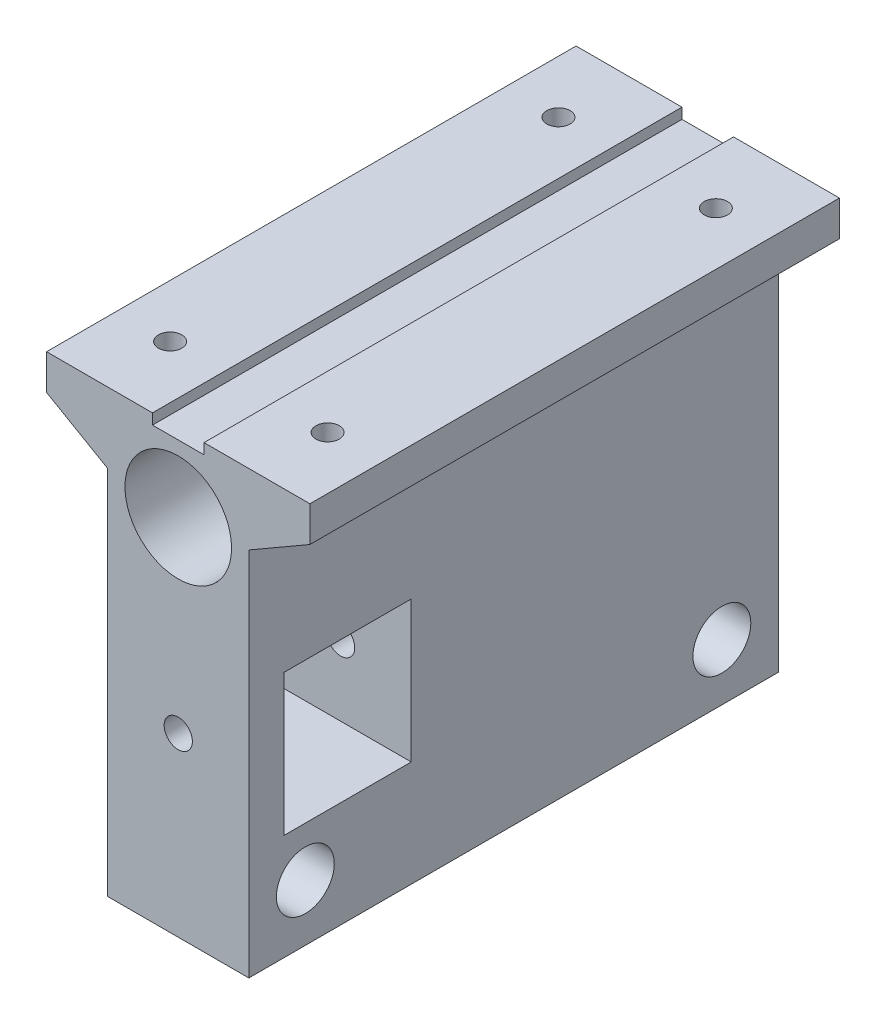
SolidWorks part; units mm, degrees
ref_plane "Alzado" through (0, 0, 0) normal (0, 0, 1) x (1, 0, 0)
ref_plane "Planta" through (0, 0, 0) normal (0, 1, 0) x (1, 0, 0)
ref_plane "Vista lateral" through (0, 0, 0) normal (1, 0, 0) x (0, 0, -1)
sketch "Croquis1" plane through (0, 0, 0) normal (0, 0, 1) x (1, 0, 0)
  line L0 (-3.65, 11) -> (-3.65, 9.5)
  line L2 (-10, 1.0059) -> (-10, -51.5)
  line L3 (-10, -51.5) -> (10, -51.5)
  line L4 (10, 1.0059) -> (10, -51.5)
  line L5 (-3.65, 9.5) -> (3.65, 9.5)
  line L6 (3.65, 9.5) -> (3.65, 11)
  line L8 (0, 0) -> (0, 16.9033) construction
  line L9 (-3.65, 11) -> (-18.65, 11)
  line L10 (-18.65, 11) -> (-18.65, 6)
  line L11 (-18.65, 6) -> (-10, 1.0059)
  line L12 (18.65, 6) -> (10, 1.0059)
  line L13 (18.65, 11) -> (18.65, 6)
  line L14 (3.65, 11) -> (18.65, 11)
  circle A0 centre (0, 0) radius 4.1 construction
  circle A1 centre (0, 0) radius 7.55
  point P7 (0, 0)
  point P13 (0, 0)
  point P17 (0, 0)
  point P18 (0, 0)
  point P19 (0, 0)
  point P20 (0, 0)
  point P22 (3.65, 9.5)
  point P24 (10, 3.9436)
  dimension "D1" = 8.2
  dimension "D5" = 15.1
  dimension "D2" = 1.5
  dimension "D3" = 7.3
  dimension "D6" = 20
  dimension "D7" = 11
  dimension "D8" = 15
  dimension "D9" = 5
  dimension "D10" = 60
  dimension "D11" = 62.5
extrude "Saliente-Extruir1" add sketch "Croquis1" along normal blind 75
sketch "Croquis2" plane through (10, 0, 0) normal (1, 0, 0) x (0, 0, -1)
  line L0 (-75, -51.5) -> (0, -51.5) construction
  line L1 (-75, 11) -> (0, 11) construction
  line L2 (0, -51.5) -> (0, 1.0059) construction
  line L4 (-37.5, 11) -> (-37.5, -51.5) construction
  line L5 (-61.1, -46.5) -> (-13.9, -46.5) construction
  line L6 (-61.1, -46.5) -> (-61.1, -4.2) construction
  line L7 (-61.1, -4.2) -> (-13.9, -4.2) construction
  line L8 (-13.9, -46.5) -> (-13.9, -4.2) construction
  line L15 (-75, -51.5) -> (-75, 1.0059) construction
  circle A0 centre (-67, -43.5) radius 4.1
  circle A1 centre (-8, -43.5) radius 4.1
  point P8 (-37.5, 11)
  point P9 (-37.5, 11)
  dimension "D1" = 8.2
  dimension "D2" = 8.2
  dimension "D3" = 8
  dimension "D5" = 8
  dimension "D7" = 8
  dimension "D8" = 8
  dimension "D9" = 47.2
  dimension "D10" = 42.3
  dimension "D11" = 5
  dimension "D12" = 23.6
extrude "Cortar-Extruir1" cut sketch "Croquis2" against normal blind 10 contours A1 | A0
sketch "Croquis3" plane through (10, 0, 0) normal (1, 0, 0) x (0, 0, -1)
  line L0 (-75, -51.5) -> (-75, 1.0059) construction
  line L1 (-70, -16.5) -> (-52, -16.5)
  line L2 (-70, -16.5) -> (-70, -36.5)
  line L3 (-70, -36.5) -> (-52, -36.5)
  line L4 (-52, -16.5) -> (-52, -36.5)
  line L5 (-75, -51.5) -> (0, -51.5) construction
  dimension "D1" = 20
  dimension "D2" = 18
  dimension "D3" = 5
  dimension "D4" = 15
extrude "Cortar-Extruir2" cut sketch "Croquis3" against normal through all contours L2 L3 L4 L1
sketch "Croquis4" plane through (0, 0, 75) normal (0, 0, 1) x (1, 0, 0)
  line L0 (0, -51.5) -> (0, -26.5) construction
  line L1 (-10, -51.5) -> (10, -51.5) construction
  circle A0 centre (0, -26.5) radius 2
  dimension "D1" = 4
  dimension "D2" = 25
extrude "Cortar-Extruir3" cut sketch "Croquis4" against normal offset from surface (28 mm away) 5
sketch "Croquis5" plane through (0, 11, 0) normal (0, 1, 0) x (1, 0, 0)
  line L4 (-11.15, 0) -> (-11.15, -75) construction
  line L5 (11.15, 0) -> (11.15, -75) construction
  line L6 (-3.65, 0) -> (-18.65, 0) construction
  line L7 (18.65, 0) -> (3.65, 0) construction
  line L8 (18.65, -75) -> (3.65, -75) construction
  line L9 (-3.65, -75) -> (-18.65, -75) construction
  circle A0 centre (-11.15, -10) radius 1.65
  circle A1 centre (11.15, -10) radius 1.65
  circle A2 centre (-11.15, -65) radius 1.65
  circle A3 centre (11.15, -65) radius 1.65
  point P8 (-11.15, -75)
  point P9 (11.15, 0)
  point P10 (11.15, -75)
  dimension "D1" = 3.3
  dimension "D2" = 3.3
  dimension "D3" = 3.3
  dimension "D4" = 3.3
  dimension "D5" = 10
  dimension "D6" = 10
  dimension "D7" = 10
  dimension "D8" = 10
extrude "Cortar-Extruir4" cut sketch "Croquis5" against normal blind 5
